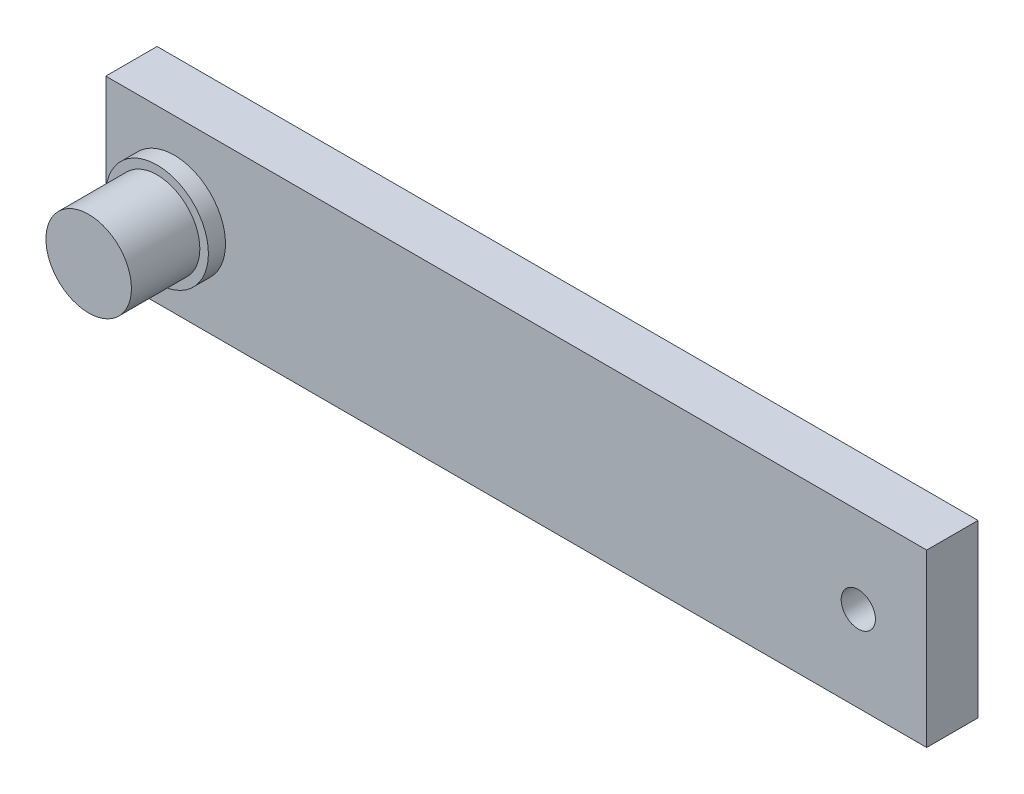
SolidWorks part; units mm, degrees
ref_plane "正面" through (0, 0, 0) normal (0, 0, 1) x (1, 0, 0)
ref_plane "平面" through (0, 0, 0) normal (0, 1, 0) x (1, 0, 0)
ref_plane "右側面" through (0, 0, 0) normal (1, 0, 0) x (0, 0, -1)
sketch "ｽｹｯﾁ1" plane through (0, 0, 0) normal (0, 0, 1) x (1, 0, 0)
  line L1 (0, 0) -> (480, 0)
  line L2 (0, 0) -> (0, 100)
  line L3 (0, 100) -> (480, 100)
  line L4 (480, 0) -> (480, 100)
  dimension "D1" = 480
  dimension "D2" = 100
extrude "押し出し1" add sketch "ｽｹｯﾁ1" along normal blind 30
sketch "ｽｹｯﾁ2" plane through (0, 0, 30) normal (0, 0, 1) x (1, 0, 0)
  line L0 (0, 0) -> (480, 0) construction
  line L3 (0, 100) -> (0, 0) construction
  circle A0 centre (40, 50) radius 30
  dimension "D1" = 60
  dimension "D2" = 50
  dimension "D3" = 40
extrude "押し出し2" add sketch "ｽｹｯﾁ2" along normal blind 10
sketch "ｽｹｯﾁ3" plane through (0, 0, 40) normal (0, 0, 1) x (1, 0, 0)
  circle A0 centre (40, 50) radius 25
  dimension "D1" = 50
extrude "押し出し3" add sketch "ｽｹｯﾁ3" along normal blind 40
sketch "ｽｹｯﾁ4" plane through (0, 0, 30) normal (0, 0, 1) x (1, 0, 0)
  line L0 (480, 0) -> (480, 100) construction
  line L3 (0, 0) -> (480, 0) construction
  circle A0 centre (440, 50) radius 10
  dimension "D1" = 20
  dimension "D2" = 40
  dimension "D3" = 50
extrude "押し出し4" cut sketch "ｽｹｯﾁ4" against normal through all
